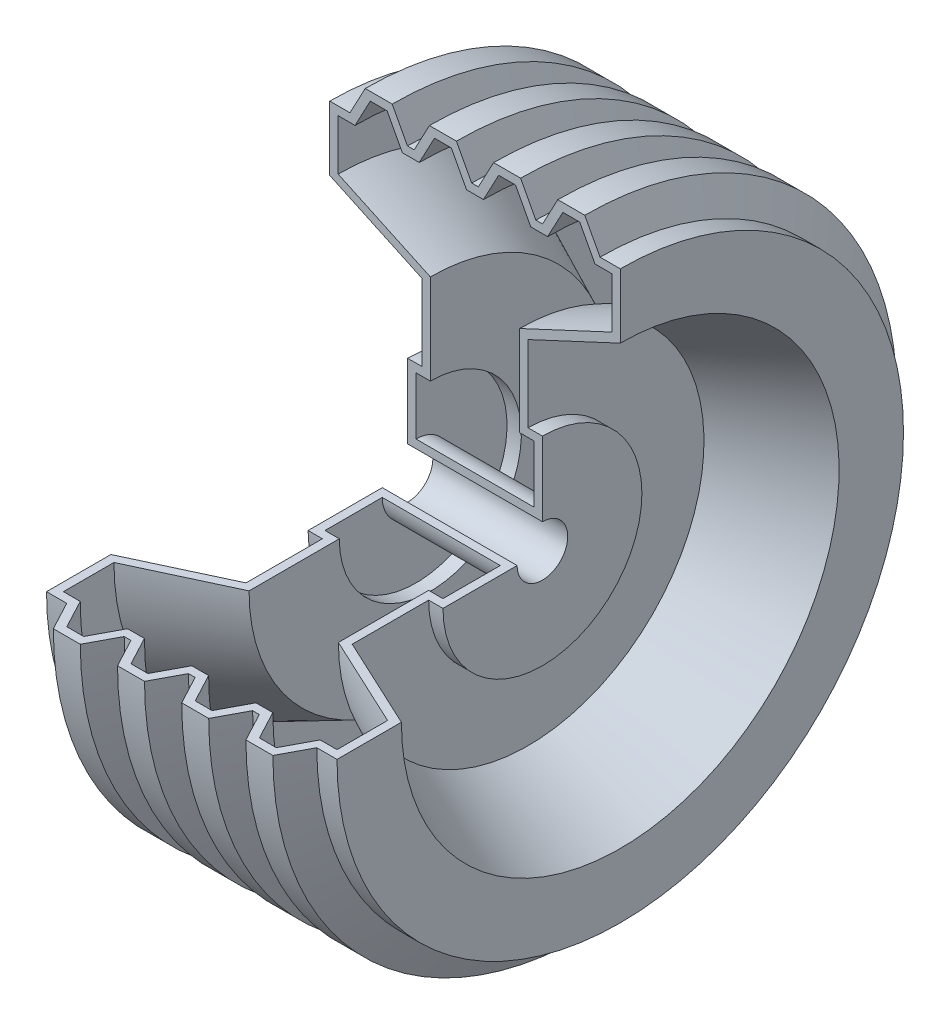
SolidWorks part; units mm, degrees
ref_plane "Front Plane" through (0, 0, 0) normal (0, 0, 1) x (1, 0, 0)
ref_plane "Top Plane" through (0, 0, 0) normal (0, 1, 0) x (1, 0, 0)
ref_plane "Right Plane" through (0, 0, 0) normal (1, 0, 0) x (0, 0, -1)
sketch "Sketch1" plane through (0, 0, 0) normal (0, 0, 1) x (1, 0, 0)
  line L0 (-56.6547, 0) -> (69.8986, 0) construction
  line L1 (0, 180) -> (0, -30.7186) construction
  line L2 (-35, 20) -> (35, 20)
  line L3 (35, 20) -> (35, 54)
  line L4 (-35, 20) -> (-35, 54)
  line L5 (35, 54) -> (26.5, 54)
  line L6 (-35, 54) -> (-26.5, 54)
  line L7 (26.5, 54) -> (26.5, 107.5134)
  line L8 (-26.5, 54) -> (-26.5, 107.5134)
  line L9 (26.5, 107.5134) -> (81.1562, 133)
  line L10 (-26.5, 107.5134) -> (-81.1562, 133)
  line L11 (81.1562, 133) -> (81.1562, 163)
  line L12 (-81.1562, 133) -> (-81.1562, 163)
  line L13 (81.1562, 163) -> (71.1562, 163)
  line L14 (-81.1562, 163) -> (-71.1562, 163)
  line L15 (71.1562, 163) -> (62.1172, 180)
  line L16 (-71.1562, 163) -> (-62.1172, 180)
  line L17 (62.1172, 180) -> (52.1172, 180)
  line L18 (-62.1172, 180) -> (-52.1172, 180)
  line L19 (52.1172, 180) -> (43.0781, 163)
  line L20 (-52.1172, 180) -> (-43.0781, 163)
  line L21 (43.0781, 163) -> (33.0781, 163)
  line L22 (-43.0781, 163) -> (-33.0781, 163)
  line L23 (33.0781, 163) -> (24.0391, 180)
  line L24 (-33.0781, 163) -> (-24.0391, 180)
  line L25 (24.0391, 180) -> (14.0391, 180)
  line L26 (-24.0391, 180) -> (-14.0391, 180)
  line L27 (14.0391, 180) -> (5, 163)
  line L28 (-14.0391, 180) -> (-5, 163)
  line L29 (5, 163) -> (-5, 163)
  point P8 (0, 20)
  point P34 (0, 163)
  dimension "D1" = 40
  dimension "D2" = 108
  dimension "D3" = 360
  dimension "D4" = 30
  dimension "D5" = 70
  dimension "D6" = 53
  dimension "D7" = 17
  dimension "D8" = 10
  dimension "D9" = 62
  dimension "D11" = 65
  dimension "D12" = 10
revolve "Revolve-Thin1" add sketch "Sketch1" angle 270 about L0
